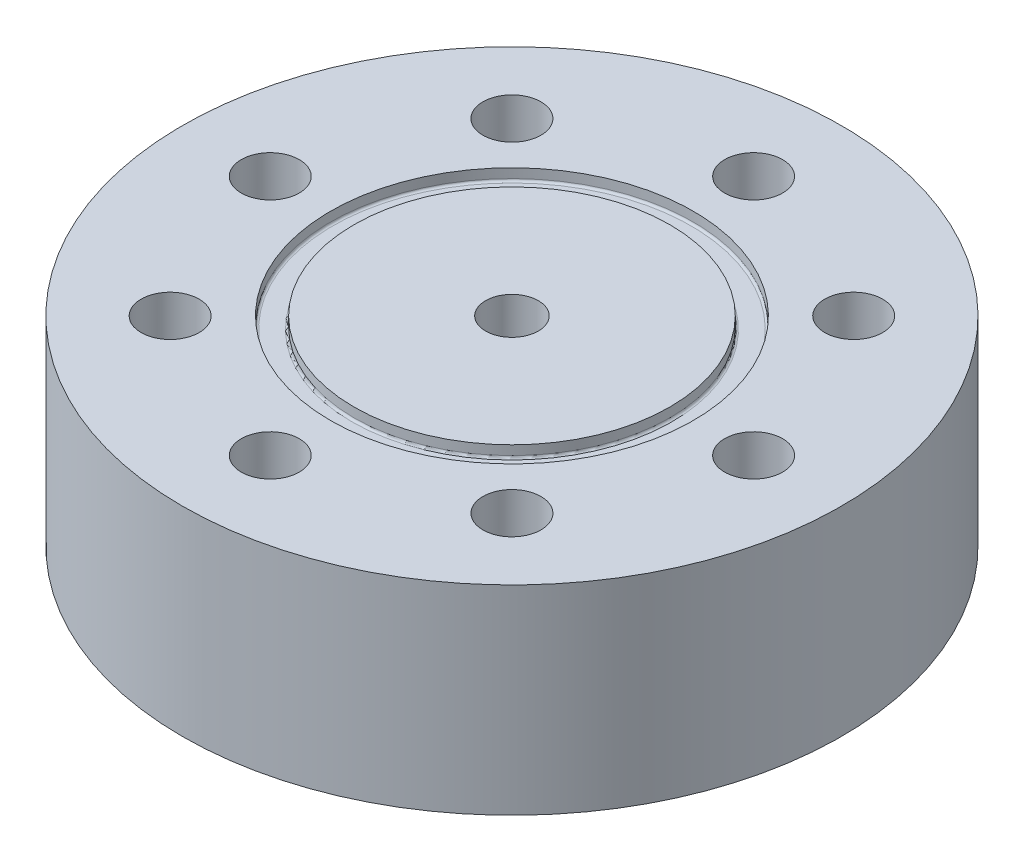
SolidWorks part; units mm, degrees
ref_plane "Front Plane" through (0, 0, 0) normal (0, 0, 1) x (1, 0, 0)
ref_plane "Top Plane" through (0, 0, 0) normal (0, 1, 0) x (1, 0, 0)
ref_plane "Right Plane" through (0, 0, 0) normal (1, 0, 0) x (0, 0, -1)
sketch "Sketch2" plane through (0, 0, 0) normal (0, 1, 0) x (1, 0, 0)
  circle A0 centre (0, 0) radius 37.5
  dimension "D1" = 75
extrude "Outer Cylinder" add sketch "Sketch2" along normal blind 22.7
sketch "Sketch3" plane through (0, 0, 0) normal (0, -1, 0) x (1, 0, 0)
  circle A0 centre (0, 0) radius 8.93
  dimension "D1" = 17.86
extrude "NPT Hole" cut sketch "Sketch3" against normal blind 12.7
sketch "Sketch4" plane through (0, 0, 0) normal (0, -1, 0) x (1, 0, 0)
  circle A0 centre (-27.5, 0) radius 3.3
  circle A1 centre (-19.4454, 19.4454) radius 3.3
  circle A2 centre (0, 27.5) radius 3.3
  circle A3 centre (19.4454, 19.4454) radius 3.3
  circle A4 centre (27.5, 0) radius 3.3
  circle A5 centre (19.4454, -19.4454) radius 3.3
  circle A6 centre (0, -27.5) radius 3.3
  circle A7 centre (-19.4454, -19.4454) radius 3.3
  point P19 (0, 0)
  dimension "D1" = 6.6
  dimension "D2" = 27.5
  dimension "D3" = 8
extrude "Bolt Holes" cut sketch "Sketch4" against normal through all
sketch "Sketch5" plane through (0, 22.7, 0) normal (0, 1, 0) x (1, 0, 0)
  circle A0 centre (0, 0) radius 17.9705
  circle A1 centre (0, 0) radius 20.6375
  dimension "D1" = 41.275
  dimension "D2" = 2.667
extrude "O-Ring Groove" cut sketch "Sketch5" against normal blind 1.3208
fillet "Fillet1" radius 0.254 2 edges at (0, 21.3792, 17.9705) (0, 21.3792, 20.6375)
sketch "Sketch6" plane through (0, 22.7, 0) normal (0, 1, 0) x (1, 0, 0)
  circle A0 centre (0, 0) radius 3
extrude "Inlet Flow Diameter" cut sketch "Sketch6" against normal blind 10
equation "\"D\"= 6"
equation "\"Inlet Flow Diameter\"= \"D\""
equation "\"D1@Sketch6\"=\"D\""
